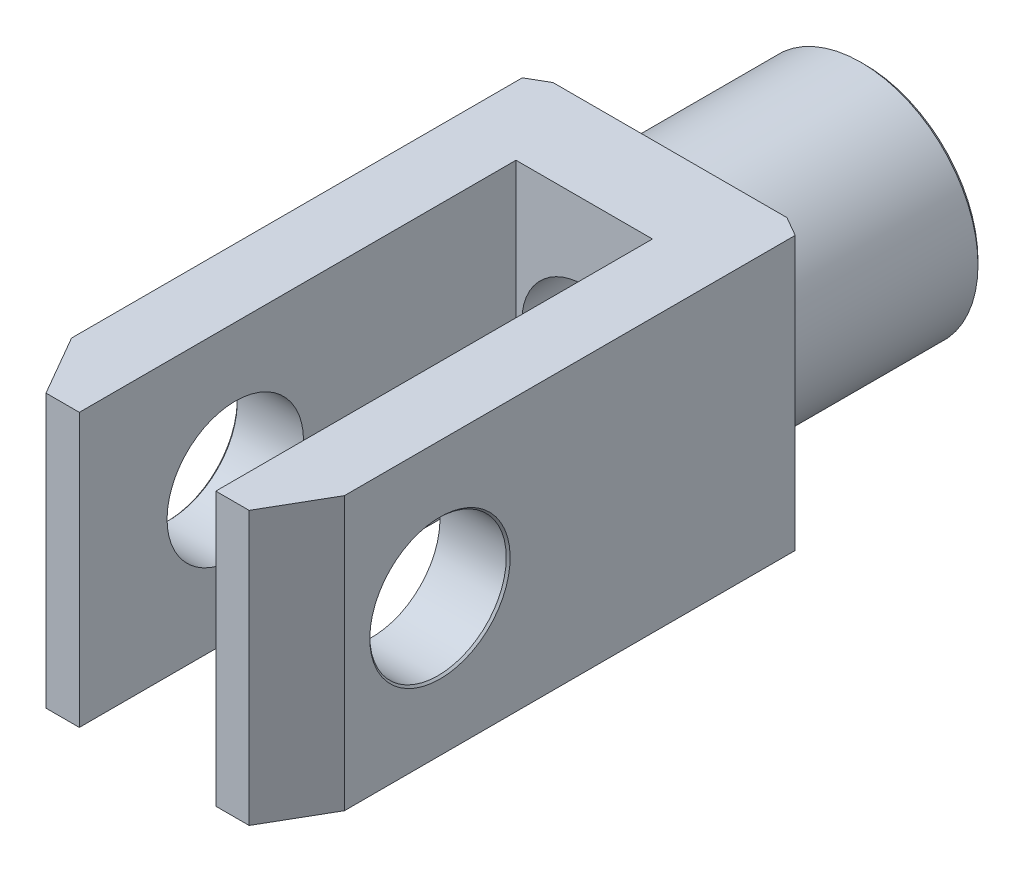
SolidWorks part; units mm, degrees
ref_plane "Front Plane" through (0, 0, 0) normal (0, 0, 1) x (1, 0, 0)
ref_plane "Top Plane" through (0, 0, 0) normal (0, 1, 0) x (1, 0, 0)
ref_plane "Right Plane" through (0, 0, 0) normal (1, 0, 0) x (0, 0, -1)
sketch "Sketch2" plane through (0, 0, 0) normal (0, 0, 1) x (1, 0, 0)
  circle A0 centre (0, 0) radius 30
  dimension "D1" = 60
extrude "Boss-Extrude1" add sketch "Sketch2" along normal blind 50
sketch "Sketch3" plane through (0, 0, 50) normal (0, 0, 1) x (1, 0, 0)
  line L0 (0, 34.3712) -> (0, -35.8936) construction
  line L1 (0, -55) -> (0, 55) construction
  line L2 (-35.0739, 0) -> (35.3081, 0) construction
  line L3 (55, 0) -> (-55, 0) construction
  line L5 (-35, 35) -> (35, 35)
  line L6 (-35, 35) -> (-35, -35)
  line L7 (-35, -35) -> (35, -35)
  line L8 (35, 35) -> (35, -35)
  dimension "D1" = 70
  dimension "D2" = 35
  dimension "D3" = 70
  dimension "D4" = 35
extrude "Boss-Extrude2" add sketch "Sketch3" along normal blind 134
sketch "Sketch4" plane through (0, 0, 184) normal (0, 0, 1) x (1, 0, 0)
  line L0 (0, 40.9195) -> (0, -41.7393) construction
  line L1 (0, -27.5) -> (0, 27.5) construction
  line L2 (-42.1491, 0) -> (45.7014, 0) construction
  line L3 (27.5, 0) -> (-27.5, 0) construction
  line L4 (35, 35) -> (-35, 35) construction
  line L5 (-17.5, 35) -> (17.5, 35)
  line L6 (-17.5, 35) -> (-17.5, -35)
  line L7 (-17.5, -35) -> (17.5, -35)
  line L8 (17.5, 35) -> (17.5, -35)
  line L9 (-35, -35) -> (35, -35) construction
  dimension "D1" = 35
  dimension "D2" = 17.5
extrude "Cut-Extrude1" cut sketch "Sketch4" against normal blind 112
sketch "Sketch5" plane through (0, 0, 0) normal (0, 0, -1) x (-1, 0, 0)
  line L0 (0, 38.2295) -> (0, -39.5332) construction
  line L1 (0, 27.5) -> (0, -27.5) construction
  line L2 (40.4125, 0) -> (-41.3835, 0) construction
  line L3 (27.5, 0) -> (-27.5, 0) construction
  circle A0 centre (0, 0) radius 16
  dimension "D1" = 32
extrude "Cut-Extrude2" cut sketch "Sketch5" against normal blind 72
chamfer "Chamfer1" distance 15.5 angle 30 2 edges at (35, 0, 184) (-35, 0, 184)
sketch "Sketch6" plane through (35, 0, 0) normal (1, 0, 0) x (0, 0, -1)
  line L0 (-144, 48.4256) -> (-144, -53.4393) construction
  line L1 (-196.4827, 0) -> (19.143, 0) construction
  line L2 (38.5, 0) -> (-38.5, 0) construction
  line L10 (0, 38.5) -> (0, -38.5) construction
  circle A0 centre (-144, 0) radius 17.5
  dimension "D1" = 144
extrude "Cut-Extrude3" cut sketch "Sketch6" against normal blind 70
chamfer "Chamfer2" distance 0.5 angle 45 2 edges at (35, 17.5, 144) (-35, 17.5, 144)
chamfer "Chamfer4" distance 1 angle 45 1 edges at (30, 0, 0)
chamfer "Chamfer6" distance 2 angle 45 1 edges at (-16, 0, 0)
chamfer "Chamfer7" distance 5 angle 30 2 edges at (35, 0, 50) (-35, 0, 50)
